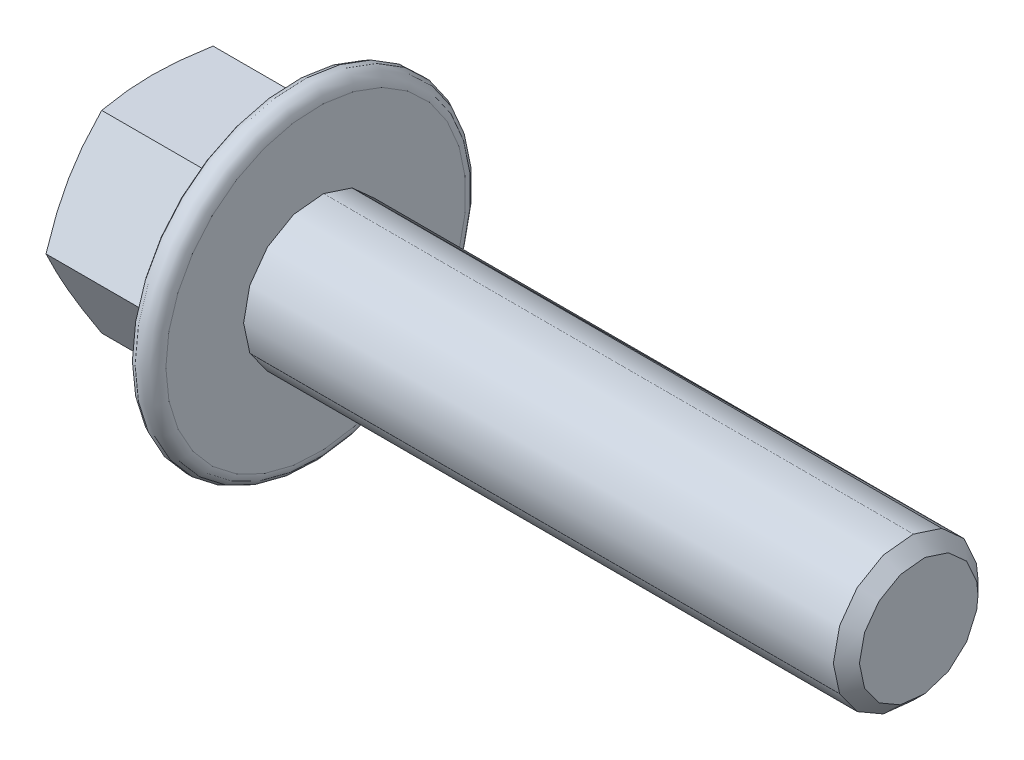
SolidWorks part; units mm, degrees
ref_plane "Front" through (0, 0, 0) normal (0, 0, 1) x (1, 0, 0)
ref_plane "Top" through (0, 0, 0) normal (0, 1, 0) x (1, 0, 0)
ref_plane "Right" through (0, 0, 0) normal (1, 0, 0) x (0, 0, -1)
sketch "Sketch1" plane through (0, 0, 0) normal (1, 0, 0) x (0, 0, -1)
  line L1 (2.3094, -4) -> (4.6188, 0)
  line L2 (4.6188, 0) -> (2.3094, 4)
  line L3 (2.3094, 4) -> (-2.3094, 4)
  line L4 (-2.3094, 4) -> (-4.6188, 0)
  line L5 (-4.6188, 0) -> (-2.3094, -4)
  line L6 (-2.3094, -4) -> (2.3094, -4)
  circle A0 centre (0, 0) radius 4 construction
  dimension "s" = 8
extrude "BaseHead" add sketch "Sketch1" along normal blind 6.8
ref_plane "Plane1" through (12.8, 0, 0) normal (1, 0, 0) x (0, 0, -1)
sketch "Sketch2" plane through (6.8, 0, 0) normal (1, 0, 0) x (0, 0, -1)
  circle A0 centre (0, 0) radius 3
extrude "BaseBody" add sketch "Sketch2" along normal blind 25
sketch "Sketch3" plane through (2.5556, 0, 2.0632) normal (0, 1, 0) x (0, 0, -1)
  line L0 (6.682, 2.5556) -> (6.682, 2.3303)
  line L2 (6.682, 2.3303) -> (6.0632, 2.5556)
  line L4 (6.0632, 2.5556) -> (6.682, 2.5556)
  line L5 (2.0632, 3.5448) -> (2.0632, 2.0587) construction
  dimension "D1" = 20
  dimension "da" = 8
revolve "HeadChamfer" cut sketch "Sketch3" angle 360 about L5
sketch "Sketch5" plane through (-3.1384, 0, 9.9384) normal (0, 1, 0) x (0, 0, -1)
  line L0 (9.9384, -9.9384) -> (9.9384, -13.5308) construction
  line L1 (14.5572, -9.9384) -> (12.2478, -9.9384) construction
  line L2 (9.9384, -9.9384) -> (16.1614, -9.9384)
  line L3 (16.4052, -8.8384) -> (9.9384, -5.8229)
  line L4 (9.9384, -5.8229) -> (9.9384, -9.9384)
  line L5 (9.9384, -34.9384) -> (9.9384, -9.9384) construction
  arc A0 (16.1614, -9.9384) -> (16.4052, -8.8384) centre (16.1614, -9.3614) ccw
  dimension "D3" = 25
  dimension "c" = 1.1
  dimension "dc" = 13.6
revolve "Revolve1" add sketch "Sketch5" angle 360 about L0
fillet "HeadFillet" [suppressed] radius 0.25
fillet "FlangeHexFillet" radius 0.4 6 edges at (4.6158, -1.0695, -4.0013) (4.6158, 2.9305, -2.9269) (4.6158, -2.9305, 2.9269) (4.6158, 1.0695, 4.0013)
chamfer "Chamfer1" distance 0.5415 angle 45 1 edges at (31.8, 0, -3)
sketch "Sketch6" plane through (0, 0, 0) normal (0, 0, 1) x (1, 0, 0)
  line L0 (30.717, 3.5415) -> (31.2585, 3.5415)
  line L1 (31.2585, 3.5415) -> (31.2585, 3)
  line L2 (31.2585, 3) -> (30.9877, 2.531)
  line L3 (30.9877, 2.531) -> (30.717, 3)
  line L4 (30.717, 3) -> (30.717, 3.5415)
  line L5 (31.2585, 3) -> (6.8, 3) construction
revolve "Cut-Revolve10" [suppressed] cut sketch "Sketch6" angle 360
pattern_linear "LPattern10" [suppressed] count 29
equation "\"b@ThreadCosmetic1\" = \"l@BaseBody\" - \"lg@Plane1\""
equation "\"D1@Chamfer1\" = (  \"d@Sketch2\" - \"D2@ThreadCosmetic1\" )  / 2"
equation "\"D1@Sketch6\" = (  \"d@Sketch2\" - \"D2@ThreadCosmetic1\" )  / 2"
equation "\"pitch@LPattern10\" = 1.2 * \"D1@Sketch6\""
equation "\"D1@LPattern10\" = \"b@ThreadCosmetic1\" / \"pitch@LPattern10\""
